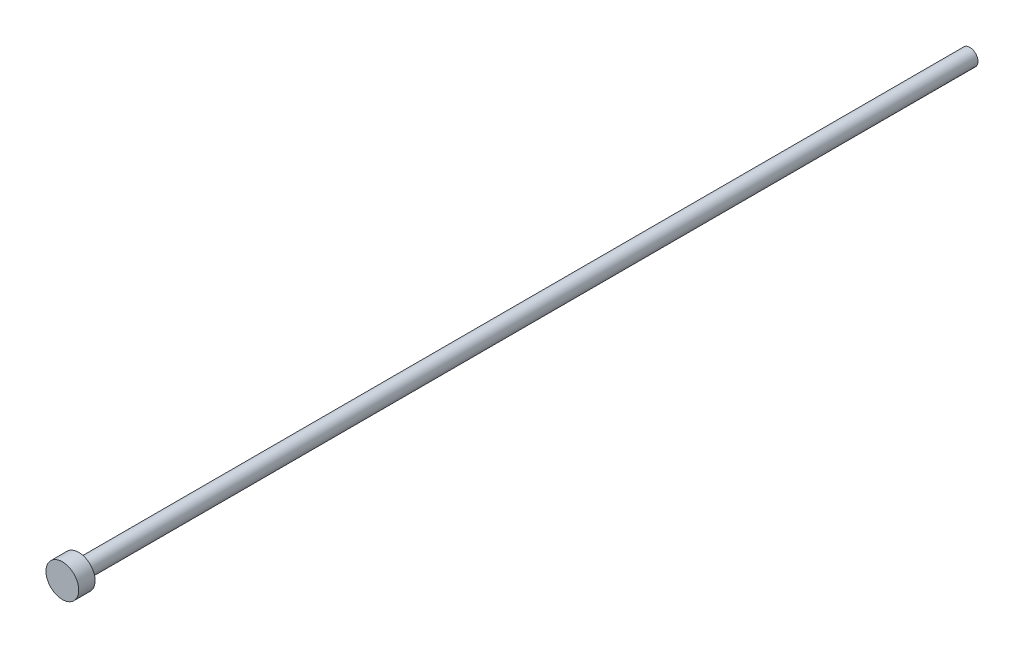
SolidWorks part; units mm, degrees
ref_plane "Face" through (0, 0, 0) normal (0, 0, 1) x (1, 0, 0)
ref_plane "Dessus" through (0, 0, 0) normal (0, 1, 0) x (1, 0, 0)
ref_plane "Droite" through (0, 0, 0) normal (1, 0, 0) x (0, 0, -1)
sketch "Esquisse1" plane through (0, 0, 0) normal (0, 0, 1) x (1, 0, 0)
  circle A0 centre (0, 0) radius 2
  dimension "D1" = 4
extrude "Tête" add sketch "Esquisse1" against normal blind 2
sketch "Esquisse2" plane through (0, 0, -2) normal (0, 0, -1) x (-1, 0, 0)
  circle A0 centre (0, 0) radius 1
  dimension "D1" = 2
extrude "Longueur" add sketch "Esquisse2" along normal offset from surface (123 mm away) 125
fillet "Congé1" radius 0.2
sketch "Esquisse3" plane through (0, 0, -125) normal (0, 0, -1) x (-1, 0, 0)
  circle A1 centre (0, 0) radius 1
  circle A2 centre (0, 0) radius 1
  dimension "D1" = 0
extrude "Mise à longueur" cut sketch "Esquisse3" against normal up to surface (13.6907 mm away)
sketch "Esquisse4" plane through (0, 0, -111.3093) normal (0, 0, -1) x (-1, 0, 0)
  circle A1 centre (0, 0) radius 1
  circle A2 centre (0, 0) radius 1
  dimension "D1" = 0
extrude "Mise à longueur + court" cut sketch "Esquisse4" against normal up to surface (0.5092 mm away)
